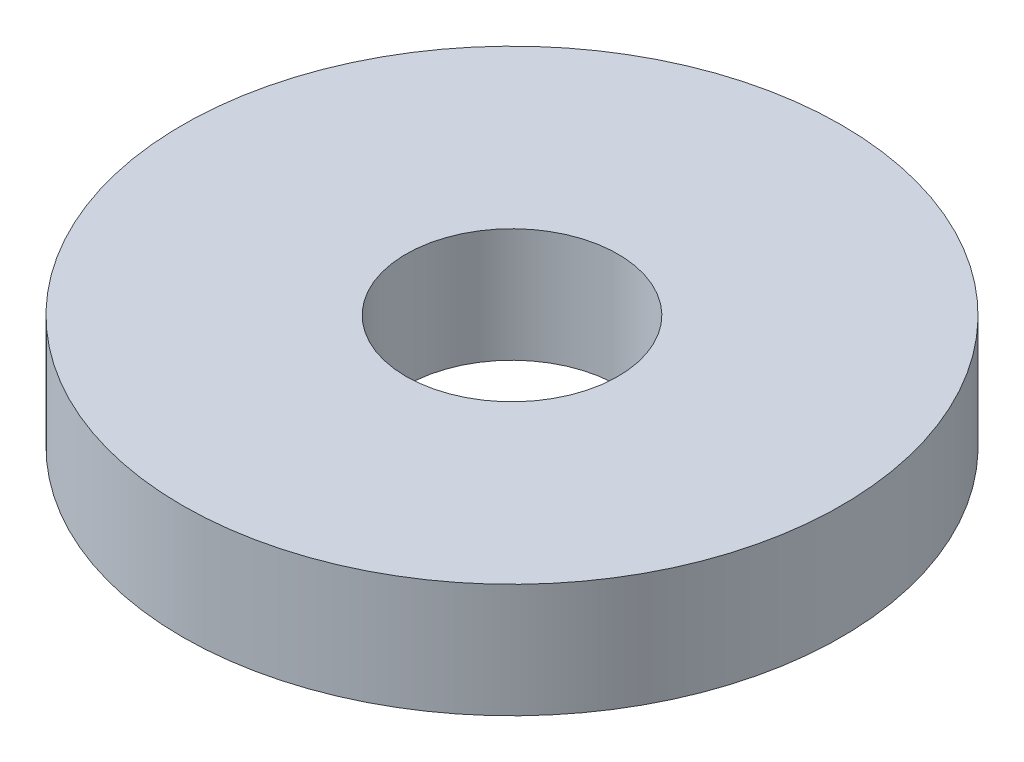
SolidWorks part; units mm, degrees
ref_plane "Front Plane" through (0, 0, 0) normal (0, 0, 1) x (1, 0, 0)
ref_plane "Top Plane" through (0, 0, 0) normal (0, 1, 0) x (1, 0, 0)
ref_plane "Right Plane" through (0, 0, 0) normal (1, 0, 0) x (0, 0, -1)
sketch "Sketch1" plane through (0, 0, 0) normal (0, 1, 0) x (1, 0, 0)
  circle A0 centre (0, 0) radius 2.5527
  circle A1 centre (0, 0) radius 7.9375
  dimension "D1" = 5.1054
  dimension "D2" = 15.875
extrude "Boss-Extrude1" add sketch "Sketch1" along normal blind 2.7432
